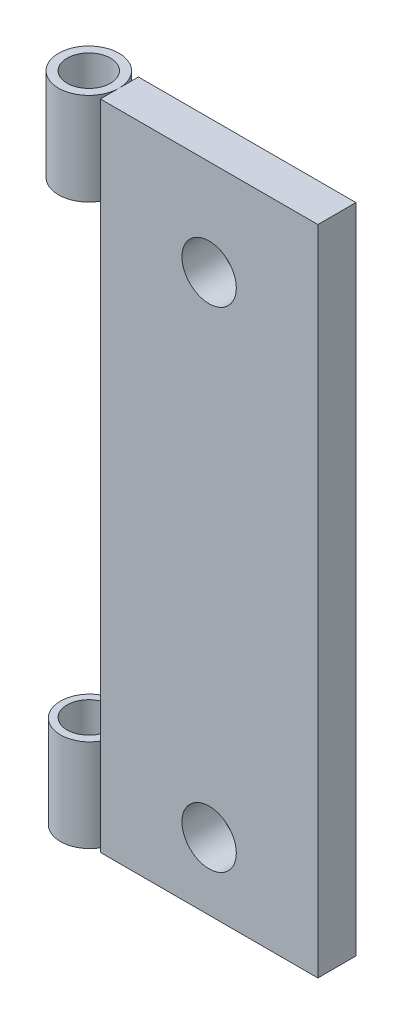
SolidWorks part; units mm, degrees
ref_plane "Front Plane" through (0, 0, 0) normal (0, 0, 1) x (1, 0, 0)
ref_plane "Top Plane" through (0, 0, 0) normal (0, 1, 0) x (1, 0, 0)
ref_plane "Right Plane" through (0, 0, 0) normal (1, 0, 0) x (0, 0, -1)
sketch "Sketch1" plane through (0, 0, 0) normal (0, 0, 1) x (1, 0, 0)
  line L1 (-20, 60) -> (20, 60)
  line L2 (-20, 60) -> (-20, -60)
  line L3 (-20, -60) -> (20, -60)
  line L4 (20, 60) -> (20, -60)
  line L5 (-20, 60) -> (20, -60) construction
  line L6 (-20, -60) -> (20, 60) construction
  point P0 (0, 0)
  dimension "D1" = 40
  dimension "D2" = 120
extrude "Boss-Extrude1" add sketch "Sketch1" along normal blind 7
sketch "Sketch3" plane through (0, 60, 0) normal (0, 1, 0) x (1, 0, 0)
  line L0 (-20, -7) -> (-20, 0) construction
  circle A0 centre (-25.5622, -3.5642) radius 5.5622
extrude "Boss-Extrude2" add sketch "Sketch3" against normal blind 17 separate body
sketch "Sketch4" plane through (0, 43, 0) normal (0, -1, 0) x (1, 0, 0)
  circle A0 centre (-25.5622, 3.5642) radius 4
  dimension "D1" = 8
extrude "Cut-Extrude1" cut sketch "Sketch4" against normal through all
sketch "Sketch5" plane through (0, -60, 0) normal (0, -1, 0) x (1, 0, 0)
  line L0 (-20, 7) -> (-20, 0) construction
  circle A0 centre (-25.3853, 3.5642) radius 5.3853
  dimension "D1" = 10.7707
extrude "Boss-Extrude3" add sketch "Sketch5" against normal blind 17 separate body
sketch "Sketch6" plane through (0, -43, 0) normal (0, 1, 0) x (1, 0, 0)
  circle A0 centre (-25.5622, -3.5642) radius 4
  dimension "D1" = 8
extrude "Cut-Extrude2" cut sketch "Sketch6" against normal through all
sketch "Sketch7" plane through (0, 0, 7) normal (0, 0, 1) x (1, 0, 0)
  line L0 (-20, 60) -> (-20, -60) construction
  circle A0 centre (0, 42.3819) radius 5
  circle A1 centre (0, -47.6181) radius 5
  dimension "D1" = 10
  dimension "D2" = 10
  dimension "D3" = 90
  dimension "D4" = 20
extrude "Cut-Extrude3" cut sketch "Sketch7" against normal through all
